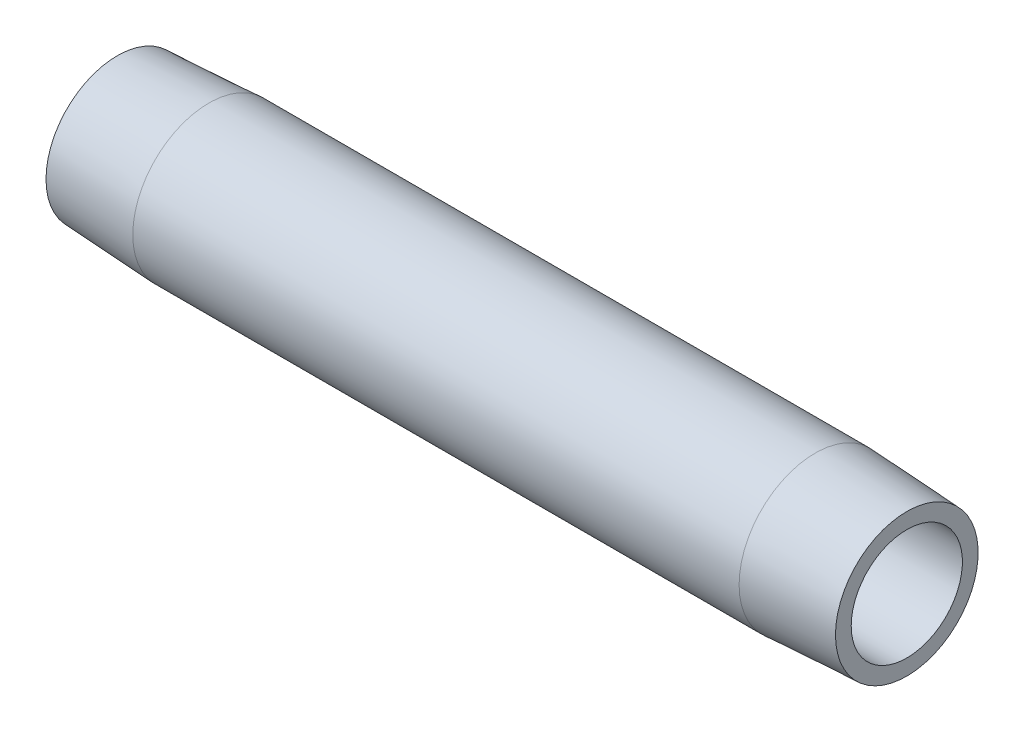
SolidWorks part; units mm, degrees
ref_plane "Front Plane" through (0, 0, 0) normal (0, 0, 1) x (1, 0, 0)
ref_plane "Top Plane" through (0, 0, 0) normal (0, 1, 0) x (1, 0, 0)
ref_plane "Right Plane" through (0, 0, 0) normal (1, 0, 0) x (0, 0, -1)
sketch "Sketch1" plane through (0, 0, 0) normal (0, 0, 1) x (1, 0, 0)
  line L5 (88.9, 6.2611) -> (0, 6.2611)
  line L6 (78.5876, 8.5725) -> (10.3124, 8.5725)
  line L7 (10.3124, 8.5725) -> (0, 8.0321)
  line L8 (88.9, 8.0321) -> (78.5876, 8.5725)
  line L9 (88.9, 6.2611) -> (88.9, 8.0321)
  line L10 (0, 6.2611) -> (0, 8.0321)
  line L11 (0, 0) -> (50000, 0) construction
  line L12 (0, -55) -> (0, 55) construction
  dimension "D1" = 12.5222
  dimension "D2" = 17.145
  dimension "D3" = 3
  dimension "D4" = 3
  dimension "D5" = 88.9
  dimension "D6" = 10.3124
  dimension "D7" = 10.3124
revolve "Revolve1" add sketch "Sketch1" angle 360 about L11
